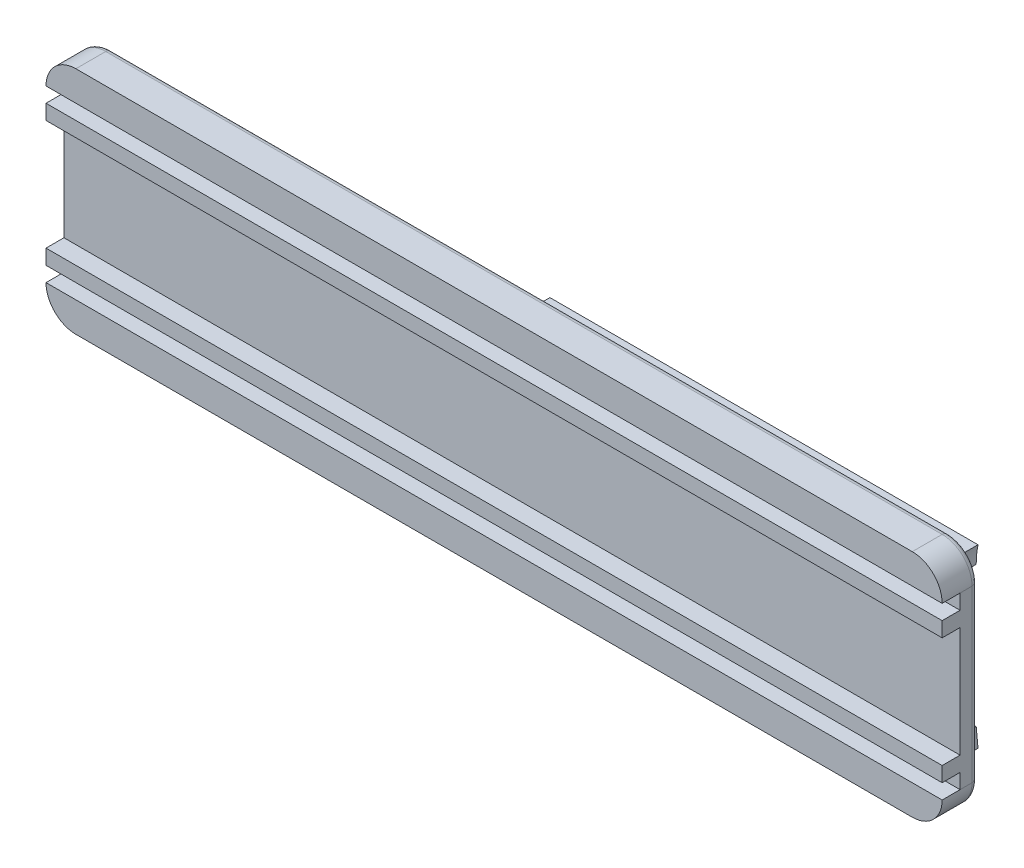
SolidWorks part; units mm, degrees
ref_plane "Ön Düzlem" through (0, 0, 0) normal (0, 0, 1) x (1, 0, 0)
ref_plane "Üst Düzlem" through (0, 0, 0) normal (0, 1, 0) x (1, 0, 0)
ref_plane "Sağ Düzlem" through (0, 0, 0) normal (1, 0, 0) x (0, 0, -1)
sketch "Çizim1" plane through (0, 0, 0) normal (0, 0, 1) x (1, 0, 0)
  line L2 (-92.7944, -56) -> (45.3965, -56)
  line L3 (-92.7944, -9) -> (45.3965, -9)
  line L4 (-92.7944, -9) -> (-97.3057, -9)
  line L5 (-97.3057, -9) -> (-97.3057, -3)
  line L6 (45.3965, -56) -> (46, -62)
  line L7 (-92.7944, -56) -> (-97.3057, -56)
  line L8 (-97.3057, -56) -> (-97.3057, -62)
  line L21 (-97.3057, -62) -> (46, -62)
  line L23 (46, -3) -> (-97.3057, -3)
  arc A0 (45.3965, -9) -> (46, -3) centre (75.5266, -9) cw
extrude "Yükseklik-Ekstrüzyon1" add sketch "Çizim1" along normal blind 10
sketch "Çizim2" plane through (0, 0, 10) normal (0, 0, 1) x (1, 0, 0)
  line L0 (-97.3057, -62) -> (46, -62) construction
  line L1 (56, 6) -> (-244, 6)
  line L2 (56, 6) -> (56, -71)
  line L3 (56, -71) -> (-244, -71)
  line L4 (-244, 6) -> (-244, -71)
  line L5 (46, -3) -> (-97.3057, -3) construction
  dimension "D1" = 9
  dimension "D2" = 9
  dimension "D3" = 300
  dimension "D4" = 10
extrude "Yükseklik-Ekstrüzyon2" add sketch "Çizim2" along normal blind 12
fillet "Radyus1" radius 10 4 edges at (56, -71, 16) (56, 6, 16) (-244, 6, 16) (-244, -71, 16)
sketch "Çizim3" plane through (0, 0, 22) normal (0, 0, 1) x (1, 0, 0)
  line L0 (-244, -4) -> (56, -4)
  line L1 (-244, -61) -> (56, -61)
  line L2 (-244, -14) -> (56, -14)
  line L3 (-244, -4) -> (-244, -61)
  line L4 (56, -61) -> (56, -4)
  line L5 (-244, -51) -> (56, -51)
  dimension "D1" = 10
  dimension "D2" = 10
extrude "Kes-Ekstrüzyon2" cut sketch "Çizim3" against normal blind 6 contours L5 L4 L2 M9
sketch "Çizim4" plane through (0, 0, 22) normal (0, 0, 1) x (1, 0, 0)
  line L0 (-244, -56) -> (56, -56)
  line L1 (56, -56) -> (56, -61)
  line L2 (-244, -61) -> (56, -61)
  line L3 (-244, -4) -> (56, -4)
  line L4 (-244, -14) -> (56, -14)
  line L5 (56, -14) -> (56, -4)
  line L6 (46, 6) -> (-234, 6)
  line L7 (-244, -4) -> (-244, -14)
  line L8 (-244, -14) -> (56, -14)
  line L9 (56, -14) -> (56, -4)
  line L10 (46, 6) -> (-234, 6)
  line L11 (-244, -4) -> (-244, -14)
  line L12 (56, -61) -> (56, -51)
  line L13 (56, -51) -> (-244, -51)
  line L14 (-244, -51) -> (-244, -61)
  line L15 (-234, -71) -> (46, -71)
  line L16 (56, -61) -> (56, -51)
  line L17 (56, -51) -> (-244, -51)
  line L18 (-244, -51) -> (-244, -61)
  line L19 (-234, -71) -> (46, -71)
  line L20 (56, -9) -> (-244, -9)
  arc A2 (56, -4) -> (46, 6) centre (46, -4) ccw
  arc A3 (-234, 6) -> (-244, -4) centre (-234, -4) ccw
  arc A4 (56, -4) -> (46, 6) centre (46, -4) ccw
  arc A5 (-234, 6) -> (-244, -4) centre (-234, -4) ccw
  arc A6 (-244, -61) -> (-234, -71) centre (-234, -61) ccw
  arc A7 (46, -71) -> (56, -61) centre (46, -61) ccw
  arc A8 (-244, -61) -> (-234, -71) centre (-234, -61) ccw
  arc A9 (46, -71) -> (56, -61) centre (46, -61) ccw
  dimension "D1" = 0
  dimension "D2" = 0
extrude "Kes-Ekstrüzyon3" cut sketch "Çizim4" against normal blind 6 contours L20 L9 L3 M18 | L0 L18 L2 L1
fillet "Radyus2" radius 2 8 edges at (-241.0711, -68.0711, 10) (-244, -32.5, 10) (-241.0711, 3.0711, 10) (-94, 6, 10) (53.0711, 3.0711, 10) (56, -32.5, 10) (53.0711, -68.0711, 10) (-94, -71, 10)
sketch "Çizim5" plane through (0, 0, 16) normal (0, 0, 1) x (1, 0, 0)
  line L4 (-244, -9) -> (56, -9)
  line L5 (56, -9) -> (56, -4)
  line L6 (56, -4) -> (-244, -4)
  line L7 (-244, -4) -> (-244, -9)
  line L8 (-244, -9) -> (56, -9)
  line L9 (56, -9) -> (56, -4)
  line L10 (56, -4) -> (-244, -4)
  line L11 (-244, -4) -> (-244, -9)
  line L12 (56, -56) -> (-244, -56)
  line L13 (-244, -56) -> (-244, -61)
  line L14 (-244, -61) -> (56, -61)
  line L15 (56, -61) -> (56, -56)
  line L16 (56, -56) -> (-244, -56)
  line L17 (-244, -56) -> (-244, -61)
  line L18 (-244, -61) -> (56, -61)
  line L19 (56, -61) -> (56, -56)
  dimension "D1" = 0
  dimension "D2" = 0
